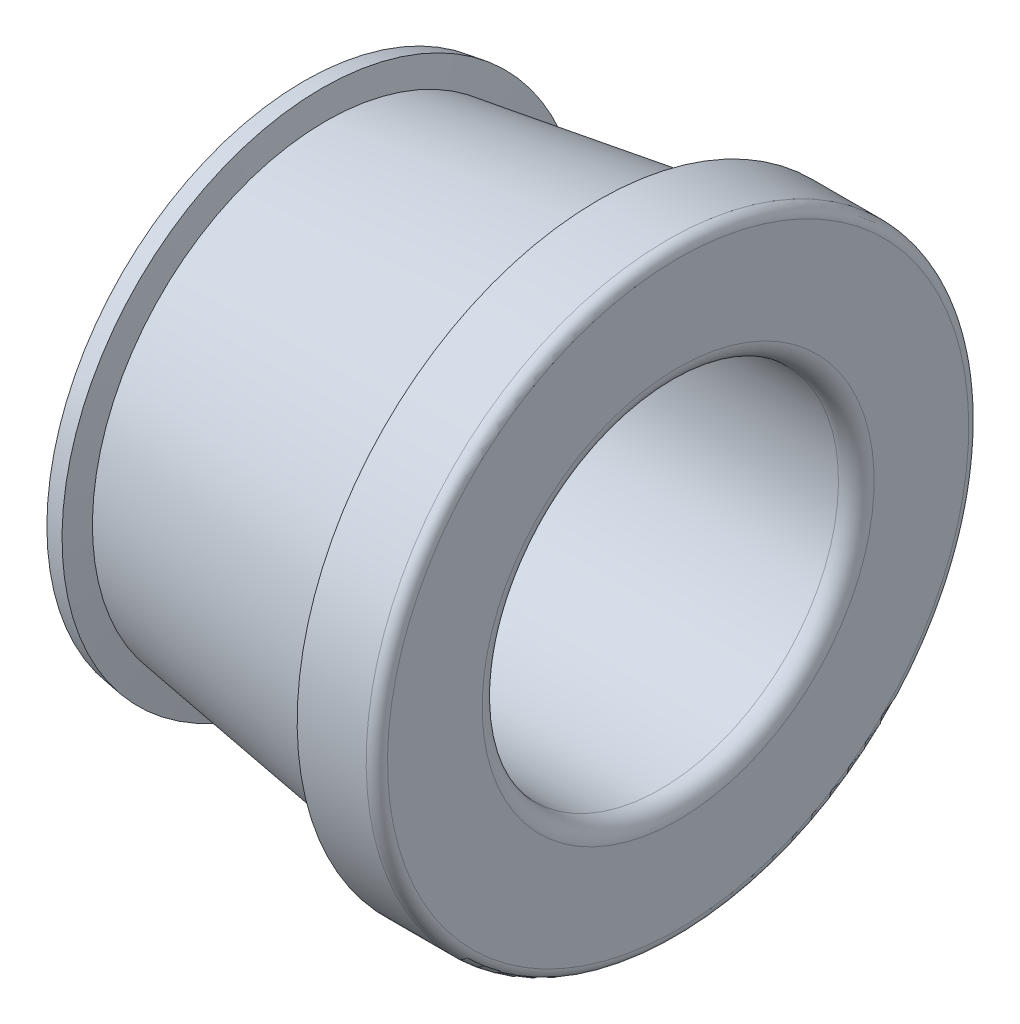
SolidWorks part; units mm, degrees
ref_plane "Plan1" through (0, 0, 0) normal (0, 0, 1) x (1, 0, 0)
ref_plane "Plan2" through (0, 0, 0) normal (0, 1, 0) x (1, 0, 0)
ref_plane "Plan3" through (0, 0, 0) normal (1, 0, 0) x (0, 0, -1)
sketch "Esquisse2" plane through (0, 0, 0) normal (0, 0, 1) x (1, 0, 0)
  line L0 (8.25, 0) -> (-29.1339, 0) construction
  line L1 (8.25, 11) -> (8.25, 16.3117)
  line L2 (7.25, 10) -> (-12.15, 10)
  line L3 (-12.75, 10.6) -> (-12.75, 14.4314)
  line L4 (-12.75, 14.4314) -> (-11.75, 14.5815)
  line L5 (3.7774, 16.9117) -> (4, 15.4283)
  line L6 (-11.75, 14.5815) -> (-11.5274, 13.0981)
  line L7 (4, 15.4283) -> (-11.5274, 13.0981)
  line L8 (3.7774, 16.9117) -> (7.65, 16.9117)
  line L9 (-14, 10) -> (8.25, 10) construction
  line L10 (8.25, 26) -> (8.25, 10) construction
  line L11 (0, 0) -> (-14, 0) construction
  line L13 (-12.75, 12.9146) -> (8.25, 16.0661) construction
  line L15 (-12.75, 12.9146) -> (-12.75, 10) construction
  line L17 (4, 26) -> (4, 23.7352) construction
  arc A0 (8.25, 11) -> (7.25, 10) centre (7.25, 11) cw
  arc A1 (-12.15, 10) -> (-12.75, 10.6) centre (-12.15, 10.6) cw
  arc A2 (8.25, 16.3117) -> (7.65, 16.9117) centre (7.65, 16.3117) ccw
  point P9 (8.25, 10)
  dimension "D5" = 1
  dimension "D3" = 0.6
  dimension "D7" = 1.5
  dimension "D9" = 1
revolve "Base-Révolution" add sketch "Esquisse2" angle 360 about L0
